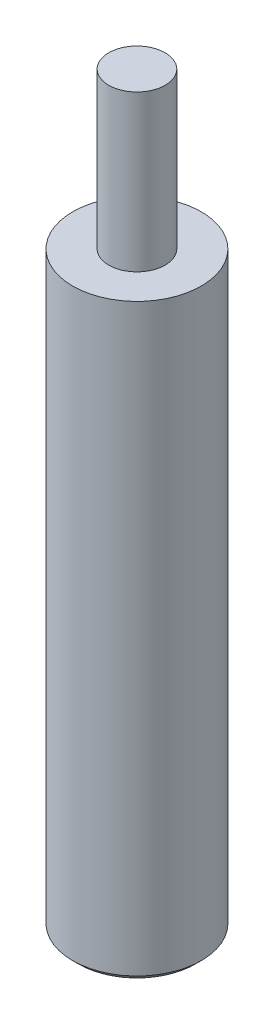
SolidWorks part; units mm, degrees
ref_plane "Front Plane" through (0, 0, 0) normal (0, 0, 1) x (1, 0, 0)
ref_plane "Top Plane" through (0, 0, 0) normal (0, 1, 0) x (1, 0, 0)
ref_plane "Right Plane" through (0, 0, 0) normal (1, 0, 0) x (0, 0, -1)
sketch "Sketch1" plane through (0, 0, 0) normal (0, 1, 0) x (1, 0, 0)
  circle A0 centre (0, 0) radius 5.5372
  dimension "D1" = 11.0744
extrude "Boss-Extrude1" add sketch "Sketch1" along normal blind 50.8
sketch "Sketch2" plane through (0, 50.8, 0) normal (0, 1, 0) x (1, 0, 0)
  circle A0 centre (0, 0) radius 2.4257
  dimension "D1" = 4.8514
extrude "Boss-Extrude2" add sketch "Sketch2" along normal blind 13.4112
chamfer "Chamfer1" distance 0.508 angle 45 1 edges at (0, 0, 5.5372)
